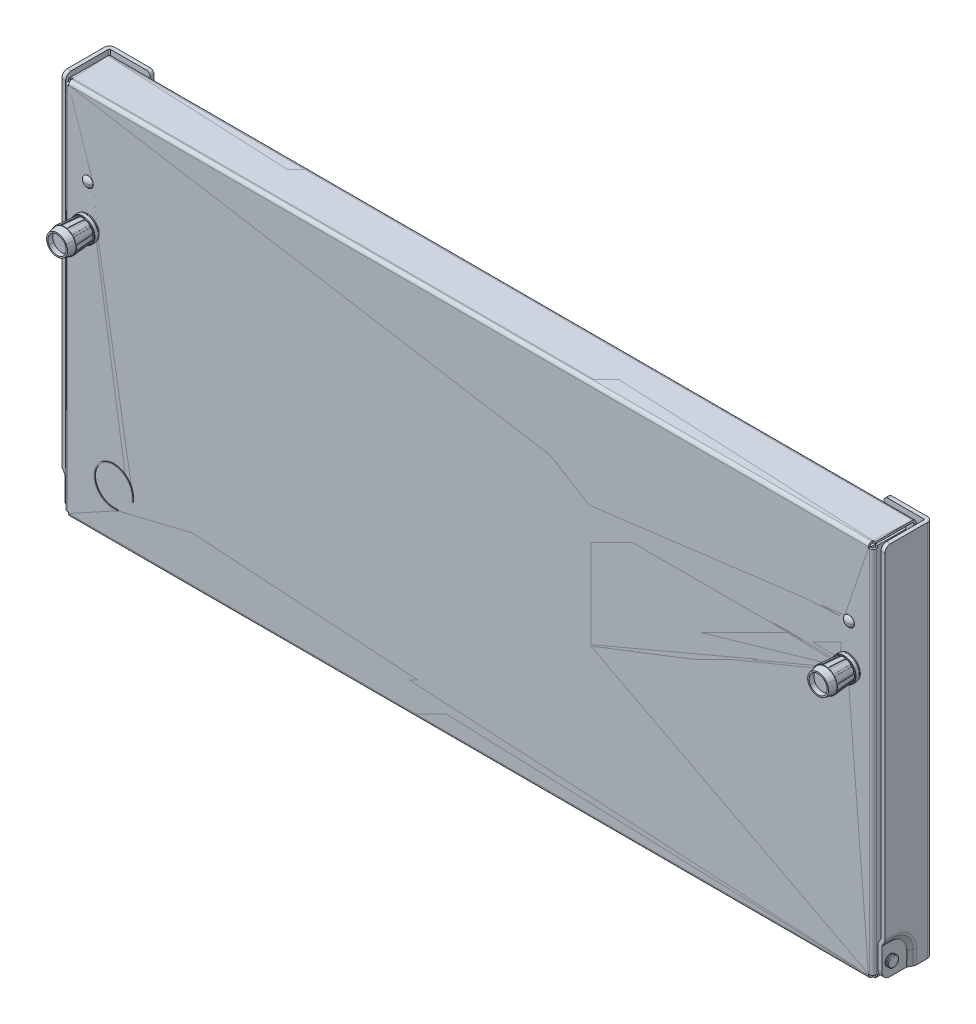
SolidWorks part; units mm, degrees
ref_plane "Front Plane" through (0, 0, 0) normal (0, 0, 1) x (1, 0, 0)
ref_plane "Top Plane" through (0, 0, 0) normal (0, 1, 0) x (1, 0, 0)
ref_plane "Right Plane" through (0, 0, 0) normal (1, 0, 0) x (0, 0, -1)
imported_body "310113358.STEP<1>"
sketch "Sketch2" plane through (100.3936, 338.1562, 0) normal (0, 0, 1) x (0, -1, 0)
  line L0 (118.6494, 136.7154) -> (178.5172, 136.7154) construction
  line L1 (249.6372, 208.4704) -> (181.6922, 208.4704)
  line L2 (252.8122, 205.2954) -> (252.8122, 68.1354)
  line L3 (249.6372, 64.9604) -> (181.6922, 64.9604)
  line L4 (178.5172, 205.2954) -> (178.5172, 68.1354)
  line L6 (181.6922, 205.2954) -> (249.6372, 68.1354) construction
  line L8 (116.6682, 371.2336) -> (116.6682, -97.8028) construction
  line L9 (119.259, -100.3936) -> (335.5654, -100.3936) construction
  circle A0 centre (168.7382, 78.9304) radius 3.175
  circle A2 centre (256.8762, 183.8324) radius 2.159
  circle A3 centre (256.8762, 88.5824) radius 2.159
  circle A4 centre (167.4682, 88.5824) radius 2.159
  circle A5 centre (167.4682, 183.8324) radius 2.159
  arc A6 (252.8122, 68.1354) -> (249.6372, 64.9604) centre (249.6372, 68.1354) cw
  arc A7 (181.6922, 64.9604) -> (178.5172, 68.1354) centre (181.6922, 68.1354) cw
  arc A8 (181.6922, 208.4704) -> (178.5172, 205.2954) centre (181.6922, 205.2954) ccw
  arc A9 (249.6372, 208.4704) -> (252.8122, 205.2954) centre (249.6372, 205.2954) cw
  dimension "D1" = 95.25
  dimension "D2" = 89.408
  dimension "D5" = 4.318
  dimension "D6" = 3.175
  dimension "D4" = 11.049
  dimension "D9" = 50.8
  dimension "D10" = 1.27
  dimension "D11" = 9.652
  dimension "D12" = 6.35
  dimension "D3" = 24.638
  dimension "D7" = 74.295
  dimension "D8" = 143.51
  dimension "D13" = 165.354
extrude "Cut-Extrude1" cut sketch "Sketch2" against normal through all
